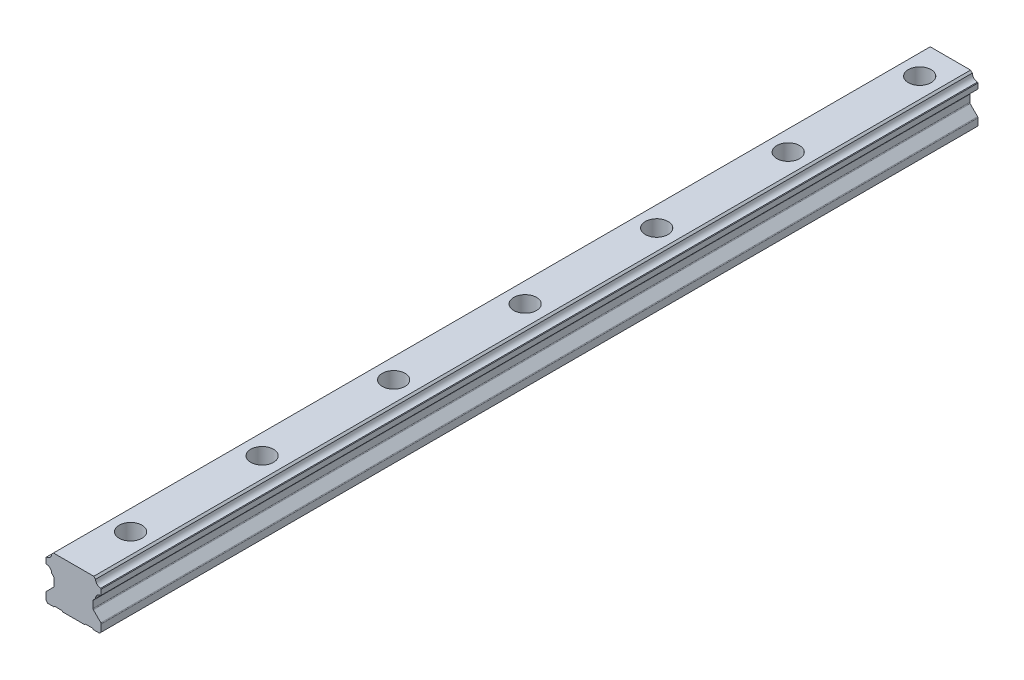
SolidWorks part; units mm, degrees
ref_plane "Front Plane" through (0, 0, 0) normal (0, 0, 1) x (1, 0, 0)
ref_plane "Top Plane" through (0, 0, 0) normal (0, 1, 0) x (1, 0, 0)
ref_plane "Right Plane" through (0, 0, 0) normal (1, 0, 0) x (0, 0, -1)
sketch "Sketch3" plane through (0, 0, 0) normal (0, 0, 1) x (1, 0, 0)
  line L0 (31.1404, 11.6596) -> (31.7645, 12.2838)
  line L1 (31.7645, 12.2838) -> (31.7645, 18.2838)
  line L2 (31.7645, 18.2838) -> (31.1394, 18.9089)
  line L3 (25.2557, 24.7927) -> (23.2646, 26.7838)
  line L4 (23.2646, 26.7838) -> (-22.7355, 26.7838)
  line L5 (-22.7355, 26.7838) -> (-24.7266, 24.7927)
  line L6 (-30.6104, 18.9089) -> (-31.2355, 18.2838)
  line L7 (-31.2355, 18.2838) -> (-31.2355, 12.2838)
  line L8 (-31.2355, 12.2838) -> (-30.6114, 11.6596)
  line L9 (-24.7266, 5.7749) -> (-22.2748, 3.3231)
  line L10 (-21.8355, 2.2624) -> (-21.8355, -5.5535)
  line L11 (-22.2748, -6.6142) -> (-30.7961, -15.1355)
  line L12 (-31.2355, -16.1961) -> (-31.2355, -24.2162)
  line L13 (-31.2355, -24.2162) -> (-29.2355, -26.2162)
  line L14 (-29.2355, -26.2162) -> (-22.2355, -26.2162)
  line L15 (-22.2355, -26.2162) -> (-21.2355, -25.2162)
  line L16 (-21.2355, -25.2162) -> (-13.2355, -25.2162)
  line L17 (-13.2355, -25.2162) -> (-12.2355, -26.2162)
  line L18 (-12.2355, -26.2162) -> (12.7645, -26.2162)
  line L19 (12.7645, -26.2162) -> (13.7645, -25.2162)
  line L20 (13.7645, -25.2162) -> (21.7645, -25.2162)
  line L21 (21.7645, -25.2162) -> (22.7645, -26.2162)
  line L22 (22.7645, -26.2162) -> (29.7645, -26.2162)
  line L23 (29.7645, -26.2162) -> (31.7645, -24.2162)
  line L24 (31.7645, -24.2162) -> (31.7645, -16.1961)
  line L25 (31.3252, -15.1355) -> (22.8039, -6.6142)
  line L26 (22.3645, -5.5535) -> (22.3645, 2.2624)
  line L27 (22.8039, 3.3231) -> (25.2556, 5.7749)
  arc A0 (25.2557, 24.7927) -> (31.1394, 18.9089) centre (31.2546, 24.9078) ccw
  arc A1 (-30.6104, 18.9089) -> (-24.7266, 24.7927) centre (-30.7255, 24.9078) ccw
  arc A2 (-24.7266, 5.7749) -> (-30.6114, 11.6596) centre (-30.7255, 5.6607) ccw
  arc A3 (-21.8355, 2.2624) -> (-22.2748, 3.3231) centre (-23.3355, 2.2624) ccw
  arc A4 (-22.2748, -6.6142) -> (-21.8355, -5.5535) centre (-23.3355, -5.5535) ccw
  arc A5 (-30.7961, -15.1355) -> (-31.2355, -16.1961) centre (-29.7355, -16.1961) ccw
  arc A6 (31.7645, -16.1961) -> (31.3252, -15.1355) centre (30.2645, -16.1961) ccw
  arc A7 (22.3645, -5.5535) -> (22.8039, -6.6142) centre (23.8645, -5.5535) ccw
  arc A8 (22.8039, 3.3231) -> (22.3645, 2.2624) centre (23.8645, 2.2624) ccw
  arc A9 (31.1404, 11.6596) -> (25.2556, 5.7749) centre (31.2546, 5.6607) ccw
extrude "Boss-Extrude1" add sketch "Sketch3" along normal blind 1000
sketch "Sketch4" plane through (0, 26.7838, 0) normal (0, 1, 0) x (1, 0, 0)
  line L0 (31.7645, -1000) -> (31.7645, 0) construction
  line L2 (23.2646, 0) -> (-22.7355, 0) construction
  point P0 (0.2645, -35)
  dimension "D1" = 31.5
  dimension "D2" = 35
hole_wizard "CBORE for M16 Hex Head Bolt1" positions "Sketch4" profile "Sketch5" counterbore size "M16" standard "DIN"
sketch "Sketch5" plane through (0.2645, 26.7838, 35) normal (1, 0, 0) x (0, 0, 1)
  line L0 (0, 0) -> (0, 53)
  line L1 (0, 53) -> (9, 53)
  line L3 (9, 53) -> (9, 22)
  line L4 (9, 22) -> (13, 22)
  line L5 (13, 22) -> (13, 0)
  line L7 (13, 0) -> (0, 0)
  line L11 (0, -6.35) -> (0, 107.95) construction
  dimension "Thru Hole Dia." = 18
  dimension "Thru Hole Depth" = 53
  dimension "C'Bore Dia." = 26
  dimension "C'Bore Depth" = 22
other "Fill Pattern1" parameters "D5"=0, "D6"=0, "D1"=150, "D2"=60, "D3"=0, "D9"=7, "D7"=7, "D8"=2
